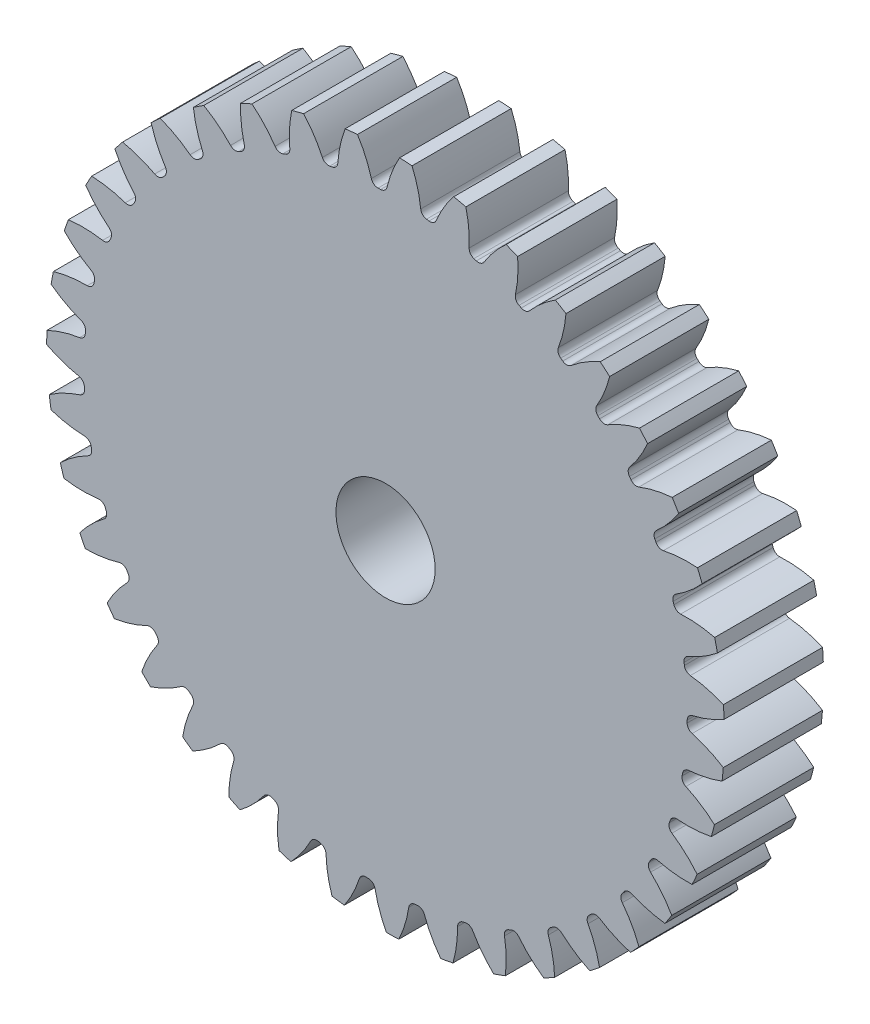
SolidWorks part; units mm, degrees
ref_plane "Front" through (0, 0, 0) normal (0, 0, 1) x (1, 0, 0)
ref_plane "Top" through (0, 0, 0) normal (0, 1, 0) x (1, 0, 0)
ref_plane "Right" through (0, 0, 0) normal (1, 0, 0) x (0, 0, -1)
sketch "Sketch3" plane through (0, 0, 0) normal (0, 0, 1) x (1, 0, 0)
  circle A0 centre (0, 0) radius 347.1333
  dimension "od" = 694.2667
extrude "gearBody" add sketch "Sketch3" along normal blind 101.6
sketch "Sketch2" plane through (0, 0, 0) normal (0, 0, 1) x (1, 0, 0)
  line L0 (0, 0) -> (286.6674, 118.7415) construction
  line L1 (346.2834, -28.5355) -> (0, 0) construction
  line L2 (0, 0) -> (36.3143, 0) construction
  line L3 (330.1299, 6.8049) -> (329.6127, -19.6847) construction
  line L5 (329.8713, -6.4399) -> (0, 0) construction
  line L7 (0, 0) -> (310.2865, 0) construction
  arc A0 (310.2849, 1.0087) -> (310.0091, -13.1184) centre (0, 0) ccw construction
  arc A1 (346.8171, 14.8145) -> (345.9746, -28.3396) centre (0, 0) ccw construction
  arc A2 (330.1299, 6.8049) -> (329.6127, -19.6847) centre (0, 0) ccw construction
  arc A3 (308.946, -7.3485) -> (308.9974, -4.7153) centre (0, 0) ccw
  arc A4 (346.2834, -28.5355) -> (313.9892, -14.1523) centre (281.8144, -129.8397) ccw
  arc A5 (346.2834, -28.5355) -> (347.1333, 14.9982) centre (0, 0) ccw
  arc A6 (347.1333, 14.9982) -> (314.3023, 1.8864) centre (286.6674, 118.7415) cw
  arc A7 (308.9974, -4.7153) -> (314.3023, 1.8864) centre (315.8884, -4.8205) cw
  arc A8 (313.9892, -14.1523) -> (308.946, -7.3485) centre (315.8359, -7.5124) cw
  point P6 (347.1333, 14.9982)
  point P22 (346.2834, -28.5355)
  dimension "baseDia" = 620.573
  dimension "od" = 694.2667
  dimension "pd" = 660.4
  dimension "rd" = 618.0667
  dimension "rFillet" = 6.8919
  dimension "pointX" = 347.1333
  dimension "pointY" = 14.9982
  dimension "CTT" = 26.4896
  dimension "flankCenterAngle" = 22.5
extrude "toothCut" cut sketch "Sketch2" along normal through all
pattern_circular "CirPattern1" count 39 over 360 about axis through (0, 0, 0) along (0, 0, 1) of "toothCut"
sketch "hub1Dia" plane through (0, 0, 0) normal (0, 0, -1) x (-1, 0, 0)
  circle A0 centre (0, 0) radius 12.7
  dimension "hub1Dia" = 25.4
sketch "hub2Dia" plane through (0, 0, 101.6) normal (0, 0, 1) x (1, 0, 0)
  circle A0 centre (0, 0) radius 12.7
  dimension "hub2dia" = 25.4
sketch "boreDia" plane through (0, 0, 0) normal (0, 0, 1) x (1, 0, 0)
  circle A0 centre (0, 0) radius 50.8
  dimension "boreDia" = 101.6
extrude "bore" cut sketch "boreDia" against normal mid plane 25400
